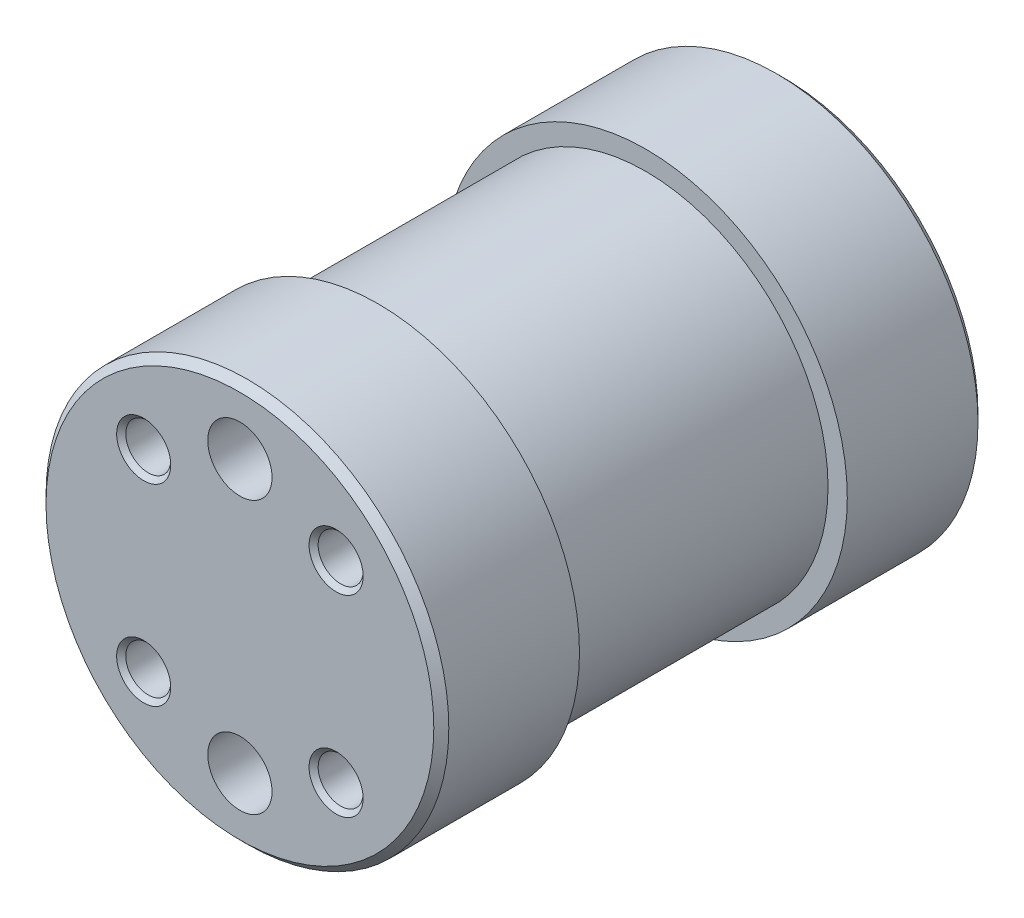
SolidWorks part; units mm, degrees
ref_plane "Front Plane" through (0, 0, 0) normal (0, 0, 1) x (1, 0, 0)
ref_plane "Top Plane" through (0, 0, 0) normal (0, 1, 0) x (1, 0, 0)
ref_plane "Right Plane" through (0, 0, 0) normal (1, 0, 0) x (0, 0, -1)
sketch "Sketch2" plane through (0, 0, 0) normal (0, 1, 0) x (1, 0, 0)
  line L0 (0, 25.4) -> (0, -25.4)
  line L1 (0, -25.4) -> (18.8, -25.4)
  line L2 (18.8, -25.4) -> (18.8, -12.5)
  line L3 (18.8, -12.5) -> (17, -12.5)
  line L4 (17, -12.5) -> (17, 12.5)
  line L5 (17, 12.5) -> (18.8, 12.5)
  line L6 (18.8, 12.5) -> (18.8, 25.4)
  line L7 (18.8, 25.4) -> (0, 25.4)
  point P3 (0, 0)
  dimension "D1" = 18.8
  dimension "D2" = 12.9
  dimension "D3" = 50.8
  dimension "D4" = 17
revolve "Revolve1" add sketch "Sketch2" angle 360 about L0
chamfer "Chamfer1" distance 0.7 angle 45 2 edges at (-18.8, 0, -25.4) (-18.8, 0, 25.4)
hole_wizard "M5x0.8 Tapped Hole1" positions "Sketch4" profile "Sketch3" tap size "M5x0.8" standard "ANSI Metric"
sketch "Sketch4" plane through (0, 0, 25.4) normal (0, 0, 1) x (1, 0, 0)
  line L2 (0, 0) -> (-16.9331, 0) construction
  line L4 (-8.9803, -8.9803) -> (0, 0) construction
  point P0 (-8.9803, -8.9803)
  dimension "D1" = 12.7
  dimension "D2" = 45
sketch "Sketch3" plane through (-8.9803, -8.9803, 25.4) normal (1, 0, 0) x (0, -1, 0)
  line L0 (0, 0) -> (0, 15.2618)
  line L1 (0, 15.2618) -> (2.1, 14)
  line L2 (2.1, 14) -> (2.1, 0.425)
  line L3 (2.1, 0.425) -> (2.525, 0)
  line L5 (2.525, 0) -> (0, 0)
  line L6 (-2.1, 0.425) -> (-2.525, 0) construction
  line L10 (0, 15.2618) -> (-2.1, 14) construction
  line L11 (0, -6.35) -> (0, 107.95) construction
  dimension "Tap Drill Dia." = 4.2
  dimension "Tap Drill Depth" = 14
  dimension "Near C'Sink Dia." = 5.05
  dimension "Near C'Sink Angle" = 90
  dimension "Drill Angle" = 118
pattern_circular "CirPattern1" count 4 over 360 about axis through (0, 0, 0) along (0, 0, 1) of "M5x0.8 Tapped Hole1"
mirror "Mirror3" about plane through (0, 0, 0) normal (0, 0, 1) of "CirPattern1", "M5x0.8 Tapped Hole1"
sketch "Sketch5" plane through (0, 0, 25.4) normal (0, 0, 1) x (1, 0, 0)
  circle A0 centre (0, 12.7) radius 3
  dimension "D1" = 6
  dimension "D2" = 12.7
extrude "Cut-Extrude1" cut sketch "Sketch5" against normal blind 10
mirror "Mirror1" about plane through (0, 0, 0) normal (0, 1, 0) of "Cut-Extrude1"
mirror "Mirror2" about plane through (0, 0, 0) normal (0, 0, 1) of "Mirror1", "Cut-Extrude1"
